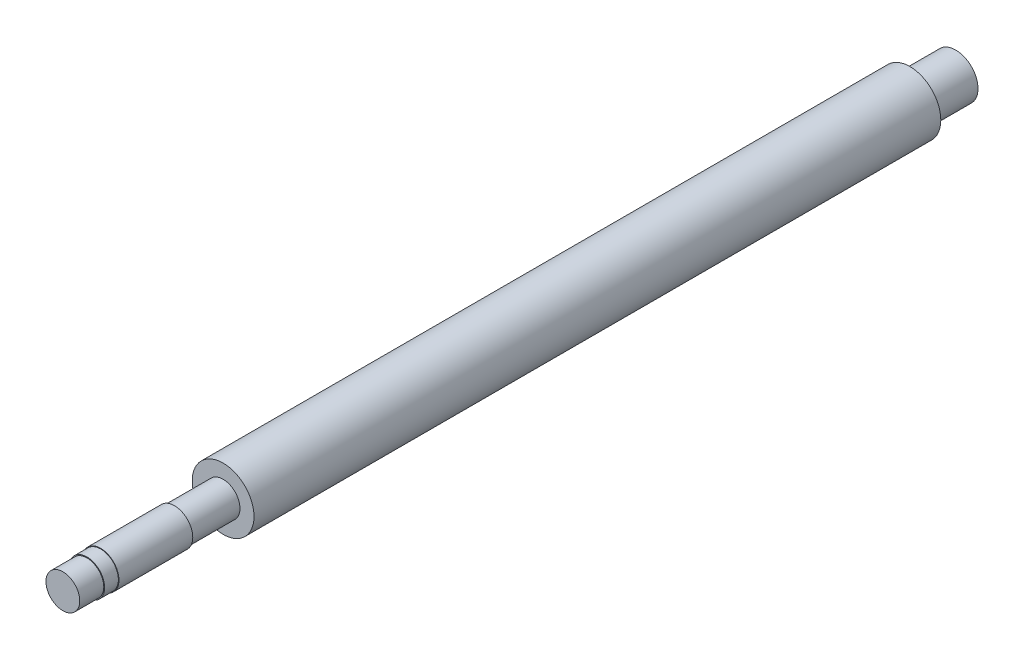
SolidWorks part; units mm, degrees
ref_plane "Plano frontal" through (0, 0, 0) normal (0, 0, 1) x (1, 0, 0)
ref_plane "Plano superior" through (0, 0, 0) normal (0, 1, 0) x (1, 0, 0)
ref_plane "Plano direito" through (0, 0, 0) normal (1, 0, 0) x (0, 0, -1)
sketch "Esboço1" plane through (0, 0, 0) normal (0, 0, 1) x (1, 0, 0)
  circle A0 centre (0, 0) radius 2.7
  dimension "D1" = 5.4
extrude "Ressalto-extrusão1" add sketch "Esboço1" along normal blind 60
sketch "Esboço2" plane through (0, 0, 60) normal (0, 0, 1) x (1, 0, 0)
  circle A0 centre (0, 0) radius 1.475
  dimension "D1" = 2.95
extrude "Ressalto-extrusão2" add sketch "Esboço2" along normal blind 14
sketch "Esboço3" plane through (0, 0, 0) normal (0, 0, -1) x (-1, 0, 0)
  circle A0 centre (0, 0) radius 1.95
  dimension "D1" = 3.9
extrude "Ressalto-extrusão3" add sketch "Esboço3" along normal blind 4
sketch "Esboço4" plane through (0, 0, 60) normal (0, 0, 1) x (1, 0, 0)
  line L0 (0, 1.475) -> (0, 2.7) construction
  line L1 (-2.2615, 1.475) -> (2.2615, 1.475) construction
  line L2 (-2.2615, 1.475) -> (2.2615, 1.475)
  line L3 (2.2615, 1.475) -> (2.2615, 2.7)
  line L4 (2.2615, 2.7) -> (-2.2615, 2.7)
  line L5 (-2.2615, 2.7) -> (-2.2615, 1.475)
  circle A0 centre (0, 0) radius 1.475 construction
  circle A1 centre (0, 0) radius 1.475 construction
  circle A3 centre (0, 0) radius 2.7 construction
  circle A4 centre (0, 0) radius 2.7 construction
ref_plane "Plano1" through (0, 0, 60) normal (0, 0, 1) x (1, 0, 0)
sketch "Esboço5" plane through (0, 0, 60) normal (0, 0, 1) x (1, 0, 0)
  line L0 (-2.2615, 2.7) -> (-2.2615, 1.475) construction
  line L1 (2.2615, 2.7) -> (-2.2615, 2.7) construction
  line L2 (2.2615, 1.475) -> (2.2615, 2.7) construction
  line L3 (-2.2615, 1.475) -> (2.2615, 1.475) construction
  line L4 (-2.2615, 2.7) -> (-2.2615, 1.475)
  line L5 (2.2615, 2.7) -> (-2.2615, 2.7)
  line L6 (2.2615, 1.475) -> (2.2615, 2.7)
  line L7 (-2.2615, 1.475) -> (2.2615, 1.475)
ref_plane "Plano2" through (0, 0, 70.7) normal (0, 0, 1) x (1, 0, 0)
sketch "Esboço6" plane through (0, 0, 70.7) normal (0, 0, 1) x (1, 0, 0)
  circle A0 centre (0, 0) radius 1.6
  dimension "D1" = 3.2
extrude "Ressalto-extrusão4" add sketch "Esboço6" against normal blind 6.45
ref_plane "Plano3" through (0, 0, 71.9) normal (0, 0, 1) x (1, 0, 0)
sketch "Esboço7" plane through (0, 0, 71.9) normal (0, 0, 1) x (1, 0, 0)
  circle A0 centre (0, 0) radius 1.55
  dimension "D1" = 3.1
extrude "Ressalto-extrusão5" add sketch "Esboço7" against normal up to next
